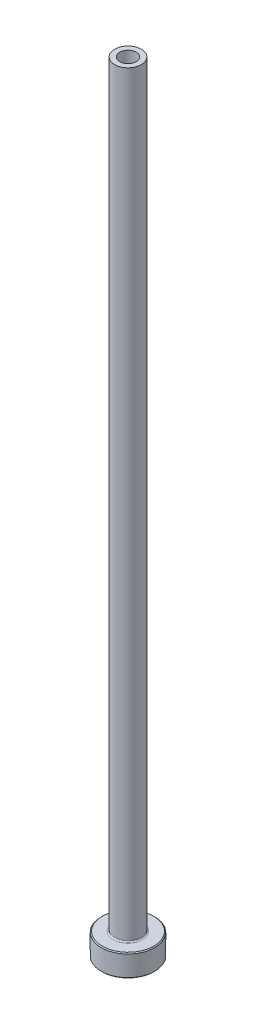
SolidWorks part; units mm, degrees
ref_plane "Front Plane" through (0, 0, 0) normal (0, 0, 1) x (1, 0, 0)
ref_plane "Top Plane" through (0, 0, 0) normal (0, 1, 0) x (1, 0, 0)
ref_plane "Right Plane" through (0, 0, 0) normal (1, 0, 0) x (0, 0, -1)
sketch "Sketch1" plane through (0, 0, 0) normal (0, 0, 1) x (1, 0, 0)
  line L0 (-1.85, 175) -> (-3, 175)
  line L1 (-3, 175) -> (-3, 5)
  line L2 (-3, 5) -> (-6, 5)
  line L3 (-6, 5) -> (-6, 0)
  line L4 (6.6, 0) -> (-6.6, 0) construction
  line L5 (-6, 0) -> (-2.1, 0)
  line L6 (-1.85, 130) -> (-1.85, 175)
  line L7 (0, 92.1877) -> (0, -15.5353) construction
  line L8 (0, -6.6) -> (0, 6.6) construction
  line L9 (-1.85, 130) -> (-2.1, 118)
  line L10 (-2.1, 118) -> (-2.1, 0)
  dimension "D1" = 0.25
  dimension "ID" = 3.7
  dimension "OD" = 6
  dimension "L" = 175
  dimension "H" = 12
  dimension "T" = 5
  dimension "N" = 45
  dimension "D2" = 12
revolve "Revolve1" add sketch "Sketch1" angle 360 about L7
fillet "Fillet1" radius 0.3 1 edges at (0, 5, 3)
chamfer "Chamfer1" distance 0.2 angle 45 2 edges at (0, 5, 6) (0, 0, 6)
chamfer "Chamfer3" distance 0.5 angle 45 1 edges at (0, 0, 2.1)
